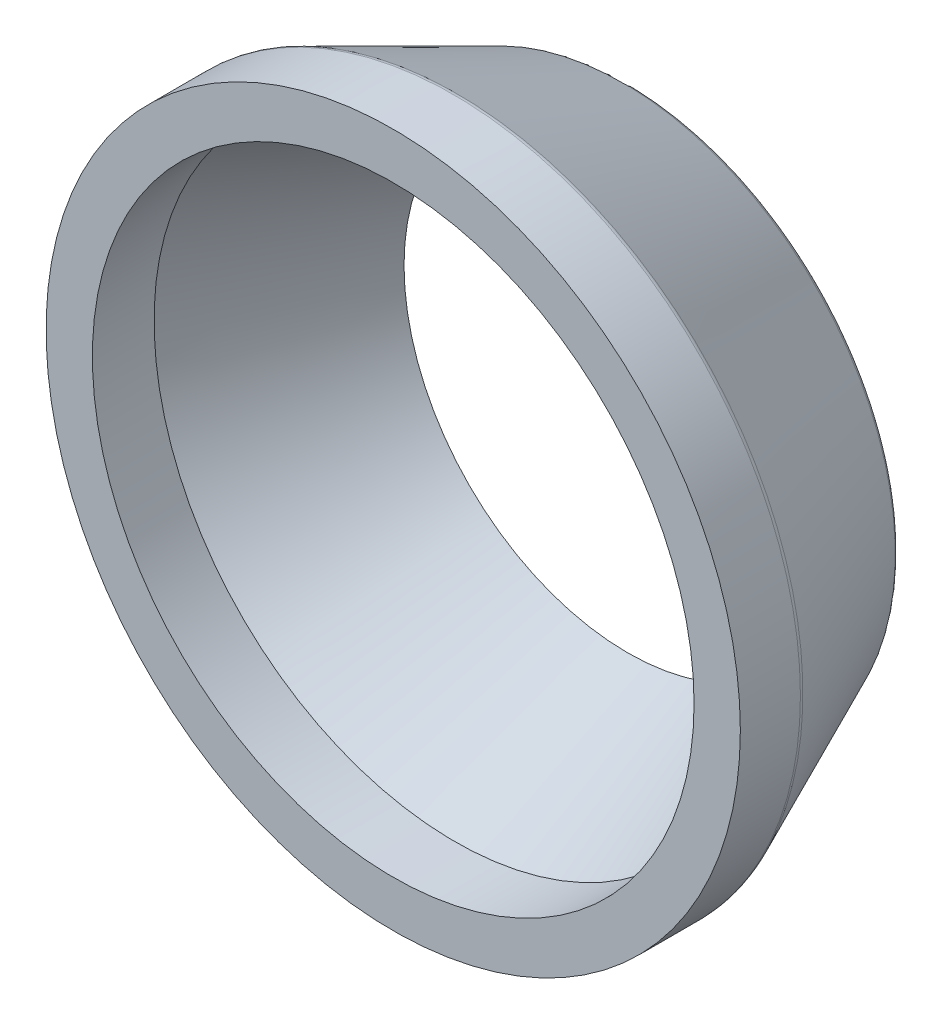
SolidWorks part; units mm, degrees
ref_plane "Front Plane" through (0, 0, 0) normal (0, 0, 1) x (1, 0, 0)
ref_plane "Top Plane" through (0, 0, 0) normal (0, 1, 0) x (1, 0, 0)
ref_plane "Right Plane" through (0, 0, 0) normal (1, 0, 0) x (0, 0, -1)
sketch "Sketch1" plane through (0, 0, 0) normal (0, 1, 0) x (1, 0, 0)
  line L0 (0, -16.8) -> (0, 26.9509) construction
  line L1 (-25.2342, 0) -> (41.8567, 0) construction
  line L2 (22.5, 0) -> (22.5, 4)
  line L3 (22.5, 4) -> (17.5, 15.2)
  line L4 (17.5, 15.2) -> (14.5, 15.2)
  line L5 (14.5, 15.2) -> (19.5, 4)
  line L6 (19.5, 4) -> (19.5, 0)
  line L7 (19.5, 0) -> (22.5, 0)
  dimension "D1" = 3
  dimension "D2" = 15.2
  dimension "D3" = 4
  dimension "D4" = 22.5
  dimension "D5" = 17.5
revolve "Revolve1" add sketch "Sketch1" angle 360 about L0
fillet "Fillet1" radius 0.5 2 edges at (17.5, 0, -15.2) (22.5, 0, -4)
